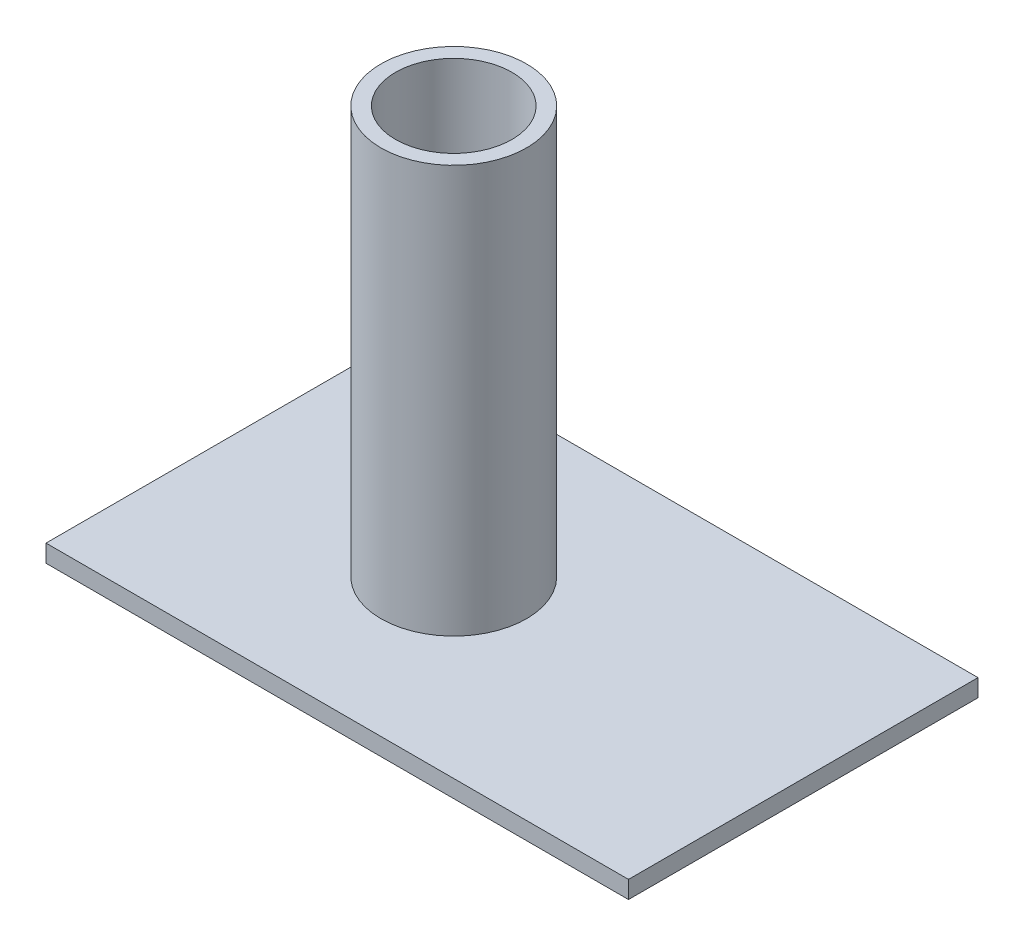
SolidWorks part; units mm, degrees
ref_plane "Front Plane" through (0, 0, 0) normal (0, 0, 1) x (1, 0, 0)
ref_plane "Top Plane" through (0, 0, 0) normal (0, 1, 0) x (1, 0, 0)
ref_plane "Right Plane" through (0, 0, 0) normal (1, 0, 0) x (0, 0, -1)
sketch "Sketch1" plane through (0, 0, 0) normal (0, 1, 0) x (1, 0, 0)
  line L0 (0, 0) -> (-10, 0) construction
  line L1 (-50, 30) -> (50, 30)
  line L2 (-50, 30) -> (-50, -30)
  line L3 (-50, -30) -> (50, -30)
  line L4 (50, 30) -> (50, -30)
  line L5 (-50, 30) -> (50, -30) construction
  line L6 (-50, -30) -> (50, 30) construction
  point P0 (0, 0)
sketch "Sketch2" plane through (0, 0, 0) normal (0, 1, 0) x (1, 0, 0)
  circle A0 centre (-10, 0) radius 12.5
  circle A1 centre (-10, 0) radius 10
extrude "Boss-Extrude1" add sketch "Sketch1" against normal blind 3 contours L3 L4 L1 L2
extrude "Boss-Extrude2" add sketch "Sketch2" along normal blind 70
